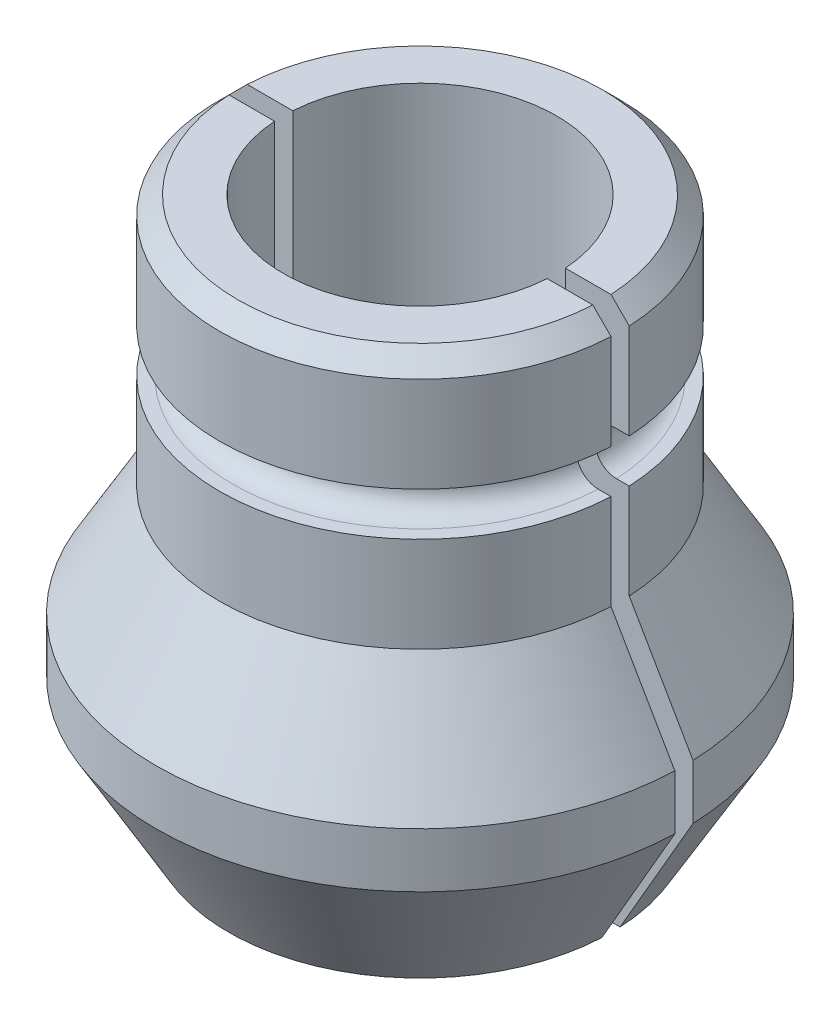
SolidWorks part; units mm, degrees
ref_plane "Front Plane" through (0, 0, 0) normal (0, 0, 1) x (1, 0, 0)
ref_plane "Top Plane" through (0, 0, 0) normal (0, 1, 0) x (1, 0, 0)
ref_plane "Right Plane" through (0, 0, 0) normal (1, 0, 0) x (0, 0, -1)
sketch "Sketch1" plane through (0, 0, 0) normal (0, 0, 1) x (1, 0, 0)
  line L0 (0, 0) -> (0, 32.5448) construction
  line L1 (7.5, 19.9) -> (10, 19.9)
  line L2 (11, 18.9) -> (11, 6.0622)
  line L4 (15.5, 0) -> (15.5, -3) construction
  line L6 (11, -3) -> (11, 0)
  line L7 (11, 0) -> (7.5, 6.0622)
  line L8 (7.5, 6.0622) -> (7.5, 19.9)
  line L9 (11, 6.0622) -> (14.5, 0)
  line L11 (14.5, 0) -> (14.5, -3)
  line L13 (11, -3) -> (7.5, -9.0622)
  line L18 (7.5, -9.0622) -> (7.5, -9.9282)
  line L19 (7.5, -9.9282) -> (10.5, -9.9282)
  line L20 (10.5, -9.9282) -> (14.5, -3)
  line L21 (10, 19.9) -> (11, 18.9)
  circle A0 centre (-41.8768, 11.9) radius 16.85
  circle A1 centre (-41.8768, 11.9) radius 14.85
  point P4 (11, 19.9)
  point P20 (0, 0)
  point P21 (0, 0)
  point P23 (15.1656, 0.2)
  point P24 (14.85, -0.1039)
  point P25 (0, 0)
  point P26 (7.5, -11.952)
  point P27 (7.5, -8.5935)
  dimension "D9" = 33.7
  dimension "D10" = 2
  dimension "D11" = 29.7
  dimension "D1" = 11
  dimension "D2" = 30
  dimension "D3" = 7.5
  dimension "D4" = 3
  dimension "D5" = 11
  dimension "D6" = 15.5
  dimension "D7" = 19.9
  dimension "D8" = 3.5
  dimension "D12" = 3
  dimension "D13" = 120
revolve "Revolve1" add sketch "Sketch1" angle 360 about L0
sketch "Sketch2" plane through (0, 0, 0) normal (1, 0, 0) x (0, 0, -1)
  line L1 (-11, 12.4811) -> (-11, 18.9) construction
  line L2 (-11, 12.4811) -> (-11, 6.0622) construction
  line L3 (-11, 12.4811) -> (-10.3, 12.4811) construction
  line L4 (-10.3, 13.6717) -> (-11, 13.6717)
  line L5 (-10.3, 11.2905) -> (-11, 11.2905)
  line L6 (-11, 11.2905) -> (-11, 11.518)
  line L7 (-11, 13.6717) -> (-11, 13.4442)
  circle A3 centre (-10.3, 12.4811) radius 1.1906
  dimension "D1" = 2.3813
  dimension "D2" = 0.7
ref_axis "Axis1" through (0, 25.112, 0) along (0, -1, 0)
revolve "Cut-Revolve1" cut sketch "Sketch2" angle 360 about axis through (0, 25.112, 0) along (0, -1, 0)
sketch "Sketch3" plane through (0, 0, 0) normal (0, 0, 1) x (1, 0, 0)
  line L0 (11, 19.9) -> (-11, 19.9) construction
  line L1 (-14.5, -9.9282) -> (14.5, -9.9282)
  line L2 (-14.5, -9.9282) -> (-14.5, 19.9)
  line L3 (-14.5, 19.9) -> (14.5, 19.9)
  line L4 (14.5, -9.9282) -> (14.5, 19.9)
  line L5 (14.5, -3) -> (14.5, 0) construction
  line L6 (-14.5, 0) -> (-14.5, -3) construction
  line L7 (-7.5, -9.9282) -> (7.5, -9.9282) construction
  point P7 (12.5, 0)
  point P8 (0, 0)
extrude "Cut-Extrude1" cut sketch "Sketch3" against normal mid plane 1
